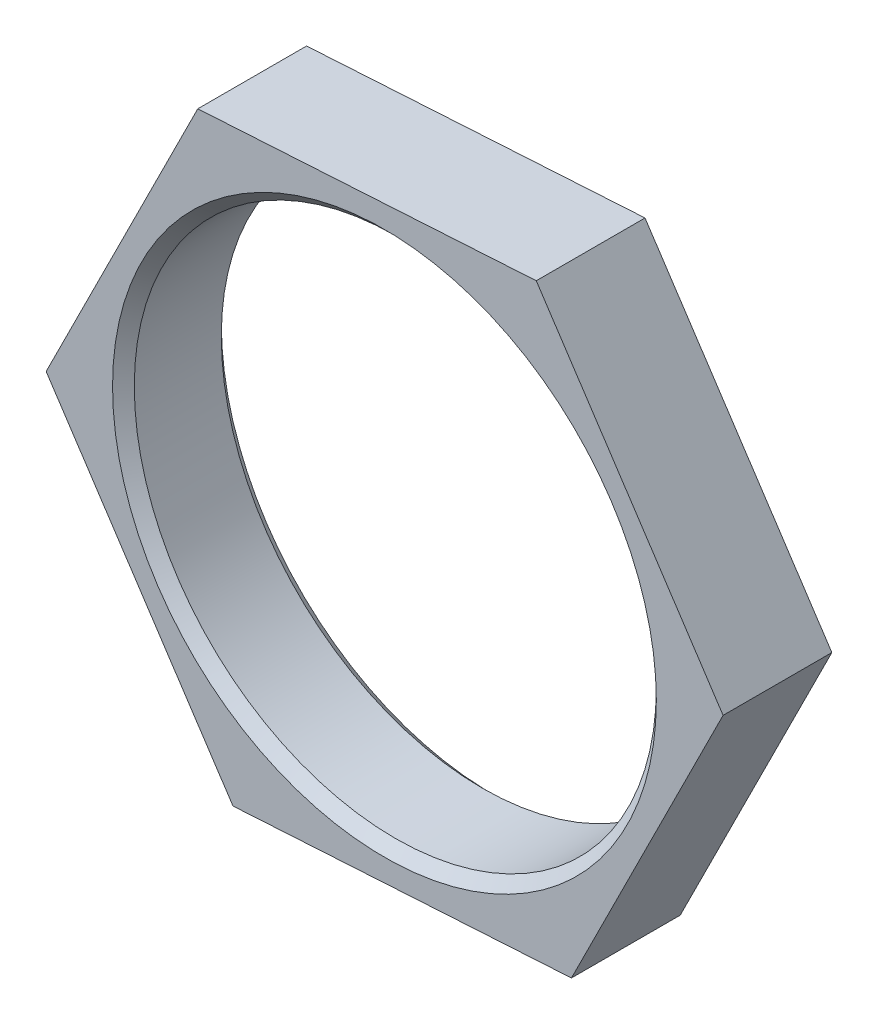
SolidWorks part; units mm, degrees
ref_plane "Plan de face" through (0, 0, 0) normal (0, 0, 1) x (1, 0, 0)
ref_plane "Plan de dessus" through (0, 0, 0) normal (0, 1, 0) x (1, 0, 0)
ref_plane "Plan de droite" through (0, 0, 0) normal (1, 0, 0) x (0, 0, -1)
sketch "Esquisse1" plane through (0, 0, 0) normal (0, 0, 1) x (1, 0, 0)
  line L1 (6.9714, 13.9427) -> (-8.5891, 13.0088)
  line L2 (-8.5891, 13.0088) -> (-15.5605, -0.934)
  line L3 (-15.5605, -0.934) -> (-6.9714, -13.9427)
  line L4 (-6.9714, -13.9427) -> (8.5891, -13.0088)
  line L5 (8.5891, -13.0088) -> (15.5605, 0.934)
  line L6 (15.5605, 0.934) -> (6.9714, 13.9427)
  circle A0 centre (0, 0) radius 13.5 construction
  dimension "D1" = 27
extrude "Extrusion1" add sketch "Esquisse1" along normal blind 5
hole_wizard "Dégagement M221" positions "Esquisse3D1" profile "Esquisse2" hole size "M22" standard "ISO"
sketch3d "Esquisse3D1"
  line L0 (-6.9714, -13.9427, 5) -> (8.5891, -13.0088, 5) construction
  point P0 (0, 0, 0)
  point P4 (-0.0084, -0.0005, 5)
  dimension "D1" = 13.5
  dimension "D2" = 15.58
sketch "Esquisse2" plane through (-0.0084, -0.0005, 5) normal (1, 0, 0) x (0, -1, 0)
  line L0 (0, 0) -> (0, 14.2103)
  line L1 (0, 14.2103) -> (12, 7)
  line L2 (12, 7) -> (12, 0)
  line L5 (12, 0) -> (0, 0)
  line L10 (0, 14.2103) -> (-12, 7) construction
  line L11 (0, -6.35) -> (0, 107.95) construction
  dimension "Diamètre du perçage" = 24
  dimension "Profondeur du perçage" = 7
  dimension "Angle de pointe" = 118
chamfer "Chanfrein1" distance 0.5 angle 45 2 edges at (-12.0084, -0.0005, 0) (11.9916, -0.0005, 5)
